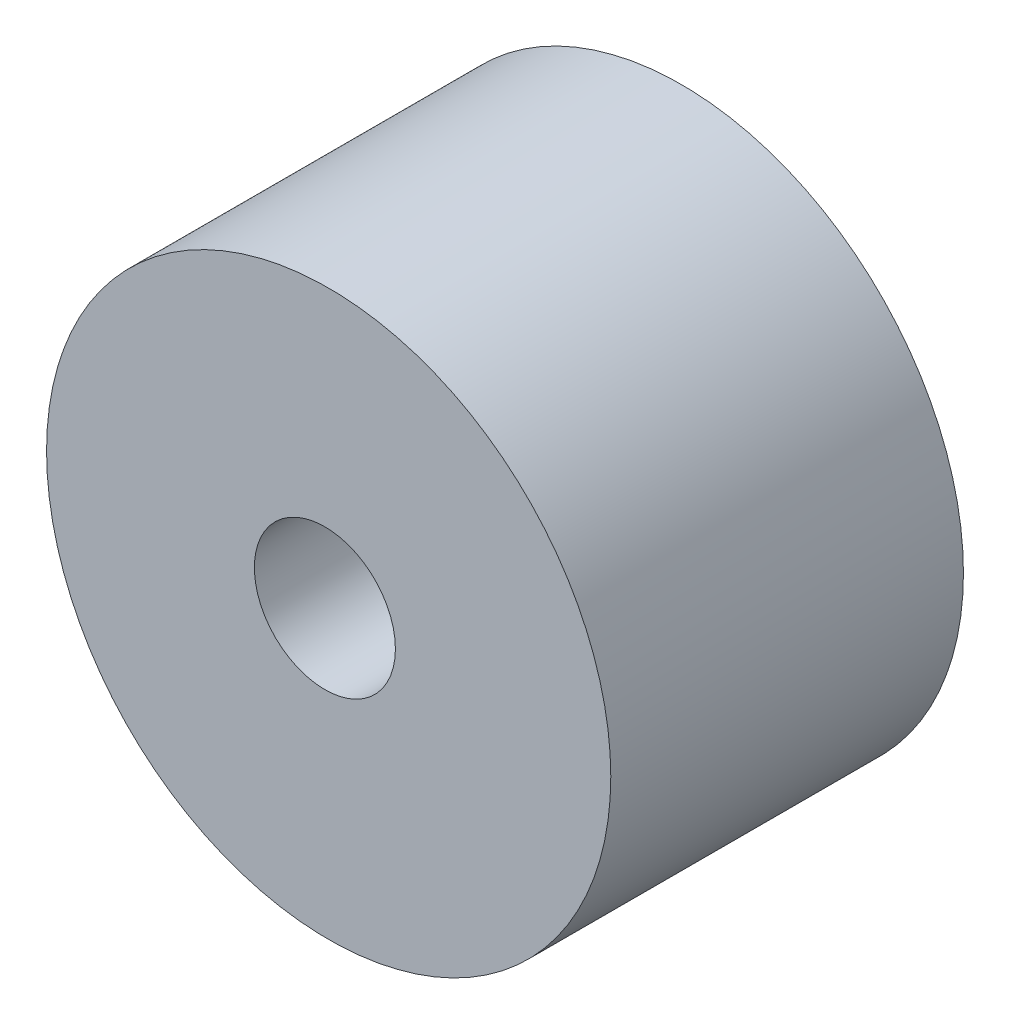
SolidWorks part; units mm, degrees
ref_plane "Front Plane" through (0, 0, 0) normal (0, 0, 1) x (1, 0, 0)
ref_plane "Top Plane" through (0, 0, 0) normal (0, 1, 0) x (1, 0, 0)
ref_plane "Right Plane" through (0, 0, 0) normal (1, 0, 0) x (0, 0, -1)
sketch "Sketch3" plane through (0, 0, 0) normal (0, 0, 1) x (1, 0, 0)
  circle A0 centre (0.3585, -0.2689) radius 40
  dimension "D1" = 80
extrude "Boss-Extrude1" add sketch "Sketch3" along normal blind 50 contours A0
sketch "Sketch4" plane through (0, 0, 50) normal (0, 0, 1) x (1, 0, 0)
  circle A0 centre (-0.1795, 0.1509) radius 10
  dimension "D1" = 20
extrude "Cut-Extrude1" cut sketch "Sketch4" against normal through all
